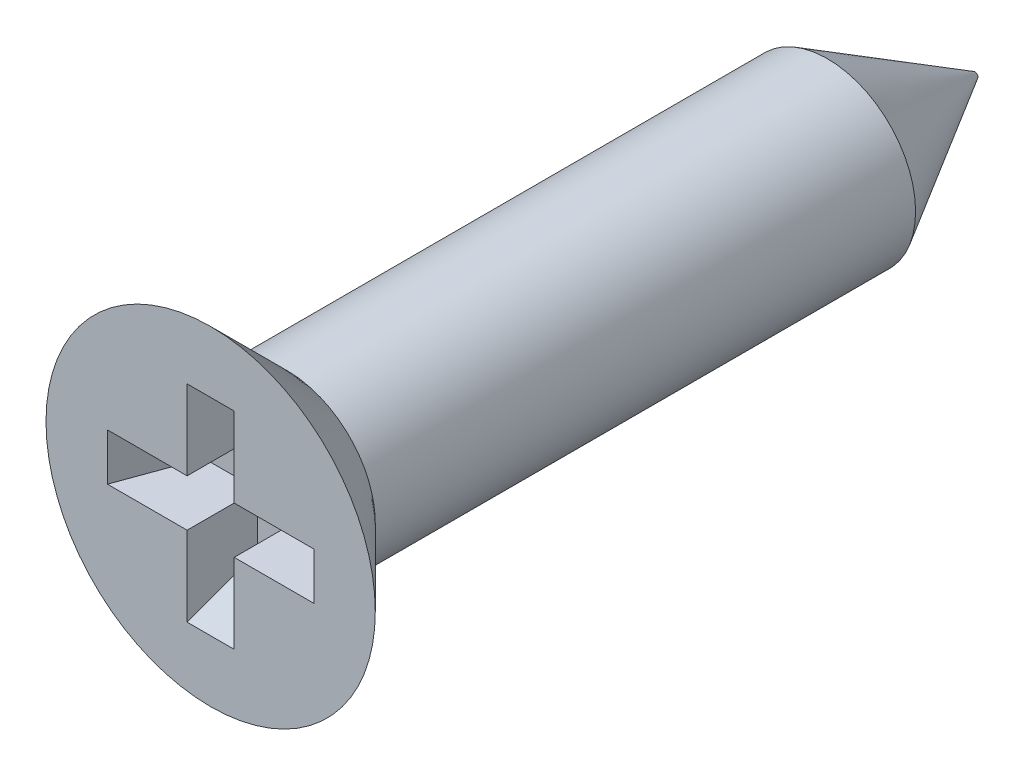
SolidWorks part; units mm, degrees
ref_plane "Plan de face" through (0, 0, 0) normal (0, 0, 1) x (1, 0, 0)
ref_plane "Plan de dessus" through (0, 0, 0) normal (0, 1, 0) x (1, 0, 0)
ref_plane "Plan de droite" through (0, 0, 0) normal (1, 0, 0) x (0, 0, -1)
sketch "Esquisse1" plane through (0, 0, 0) normal (1, 0, 0) x (0, 0, -1)
  line L0 (-1.6035, 0) -> (7.1529, 0) construction
  line L1 (0, 5.0438) -> (0, -4.594) construction
  line L2 (0, 2.8) -> (1.3, 1.5)
  line L3 (1.3, 1.5) -> (1.3, 0)
  line L4 (-1.442, 2.8) -> (2.7621, 2.8) construction
  line L5 (0, 2.8) -> (8.0274, -5.2274) construction
  line L6 (-1.0988, 1.5) -> (4.1029, 1.5) construction
  line L7 (1.3, 0) -> (0, 0)
  line L9 (0, 2.8) -> (0, 0)
  dimension "D1" = 45
revolve "Révolution2" add sketch "Esquisse1" angle 360 about L0
sketch "Esquisse3" plane through (0, 0, 0) normal (0, 0, 1) x (1, 0, 0)
  circle A0 centre (0, 0) radius 1.5
extrude "Extrusion1" add sketch "Esquisse3" against normal blind 13
sketch "Esquisse2" plane through (0, 0, 0) normal (0, 0, 1) x (1, 0, 0)
  line L0 (0.4, -0.4) -> (1.755, -0.4)
  line L1 (0.4, 0.4) -> (1.755, 0.4)
  line L2 (-1.755, -0.4) -> (-0.4, -0.4)
  line L3 (-0.4, 1.755) -> (-0.4, 0.4)
  line L4 (-1.755, 0.4) -> (-0.4, 0.4)
  line L5 (0.4, 1.755) -> (0.4, 0.4)
  line L6 (-0.4, 1.755) -> (0.4, 1.755)
  line L7 (1.755, 0.4) -> (1.755, -0.4)
  line L8 (0.4, -1.755) -> (-0.4, -1.755)
  line L9 (-1.755, -0.4) -> (-1.755, 0.4)
  line L10 (-0.4, -0.4) -> (-0.4, -1.755)
  line L12 (0.4, -0.4) -> (0.4, -1.755)
  circle A0 centre (0, 0) radius 1.8 construction
extrude "Enlèv. mat.-Extru.2" cut sketch "Esquisse2" against normal blind 1.2
draft "Dépouille3" type of draft neutral plane draft angle 20 faces to draft 4 parameters "D1"=20
chamfer "Chanfrein1" distance 1.45 angle 60 1 edges at (1.5, 0, -13)
